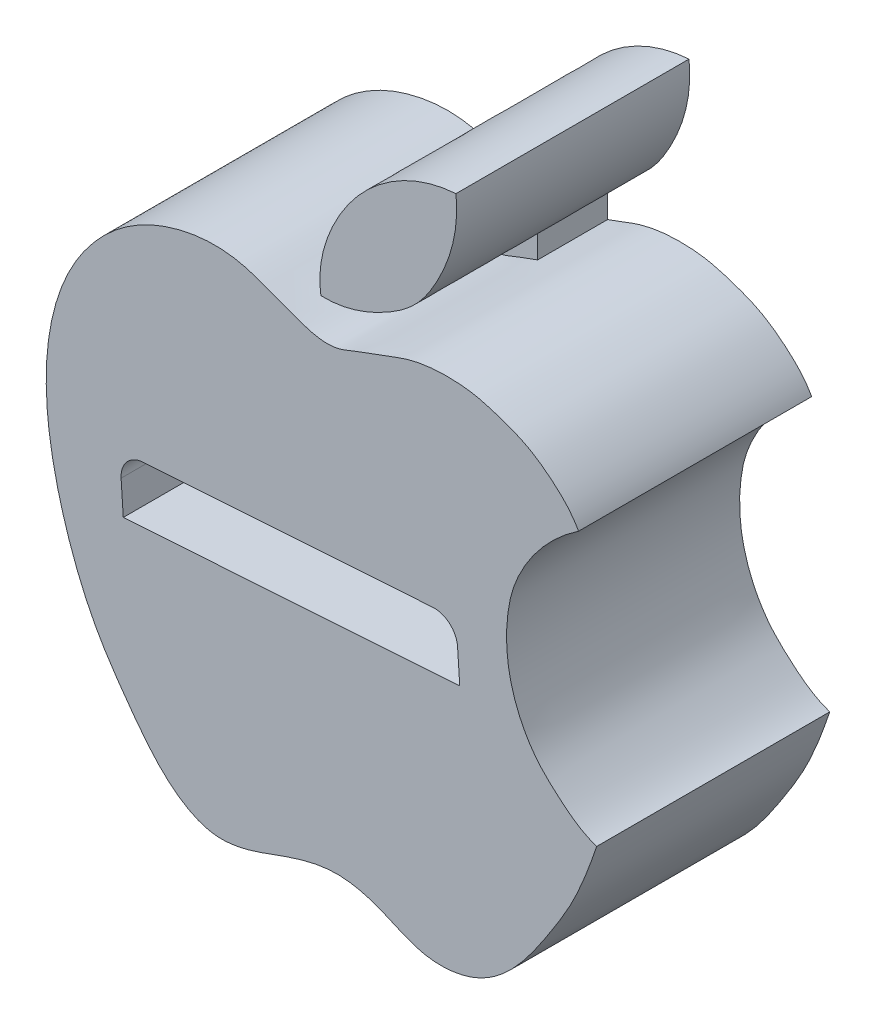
SolidWorks part; units mm, degrees
ref_plane "Front Plane" through (0, 0, 0) normal (0, 0, 1) x (1, 0, 0)
ref_plane "Top Plane" through (0, 0, 0) normal (0, 1, 0) x (1, 0, 0)
ref_plane "Right Plane" through (0, 0, 0) normal (1, 0, 0) x (0, 0, -1)
sketch "Sketch1"
  spline S0 degree 3 poles (226.9539, -62.4102) (214.1606, -58.2968) (197.4207, -45.402) (174.3626, -23.915) (159.2894, 1.2707) (149.2845, 34.7362) (148.9766, 65.5246) (153.5027, 89.4653) (167.156, 124.6374) (189.3818, 149.338) (211.4468, 164.1038) knots 0 0 0 0 0.142488 0.223895 0.337764 0.45251 0.59581 0.663481 0.71307 1 1 1 1
  spline S1 degree 3 poles (211.4468, 164.1038) (205.7181, 174.5433) (191.0904, 189.3967) (167.5659, 206.2266) (144.4457, 214.7907) (123.1417, 221.2843) (95.2038, 223.7881) (67.9232, 220.8773) (44.0446, 210.4677) (27.9655, 205.4946) (14.5837, 199.5799) (-1.3064, 194.155) (-19.6072, 197.1973) (-39.0105, 204.7876) (-56.0086, 211.0087) (-78.1896, 219.3022) (-99.5204, 221.5574) (-120.1174, 219.2611) (-136.4314, 215.7092) (-160.3796, 207.2608) (-186.4534, 190.6972) (-207.6833, 168.023) (-226.1212, 140.7454) (-237.2795, 112.2028) (-242.6466, 85.8497) (-245.8571, 59.7838) (-245.6066, 33.0315) (-240.9525, -6.1324) (-228.9343, -56.5948) (-206.7737, -112.2624) (-176.7871, -154.8899) (-155.0439, -184.1421) (-132.5344, -206.2953) (-103.7357, -219.9672) (-75.2959, -216.3483) (-40.6268, -203.4737) (-1.6938, -189.7969) (42.5018, -200.7795) (78.5928, -221.1352) (126.7878, -215.828) (161.4966, -184.6618) (185.0476, -149.6957) (209.7, -110.5439) (220.8635, -80.3256) (226.9539, -62.4102) knots 0 0 0 0 0.026752 0.046734 0.064997 0.082322 0.097011 0.128365 0.142996 0.155885 0.166411 0.176219 0.193415 0.206707 0.223677 0.234361 0.260338 0.271136 0.281277 0.298098 0.32847 0.350114 0.368075 0.40284 0.418567 0.428959 0.462303 0.478812 0.518264 0.579602 0.61296 0.636073 0.662146 0.684016 0.705484 0.7247 0.768618 0.794907 0.825219 0.861329 0.895482 0.927551 0.957031 1 1 1 1
  spline S2 degree 3 poles (-9.7343, 228.5639) (-12.7751, 248.9908) (-2.7414, 287.0768) (36.495, 340.3415) (79.0789, 360.521) (106.1612, 362.2894) knots 0 0 0 0 0.31387 0.584945 1 1 1 1
  spline S3 degree 3 poles (-9.7343, 228.5639) (8.7441, 227.8533) (38.8667, 237.8686) (71.7855, 260.2354) (98.5691, 300.134) (109.1361, 334.7644) (106.1612, 362.2894) knots 0 0 0 0 0.278566 0.466933 0.591977 1 1 1 1
extrude "Extrude1" add sketch "Sketch1" along normal blind 200
sketch "Esquisse1" plane through (0, 0, 0) normal (0, 0, -1) x (-1, 0, 0)
  line L1 (-36.3017, 252.7434) -> (4.4465, 252.7434)
  line L2 (-36.3017, 252.7434) -> (-36.3017, 176.1792)
  line L3 (-36.3017, 176.1792) -> (4.4465, 176.1792)
  line L4 (4.4465, 252.7434) -> (4.4465, 176.1792)
extrude "Boss.-Extru.1" add sketch "Esquisse1" against normal blind 60
sketch "Esquisse2" plane through (0, 0, 200) normal (0, 0, 1) x (1, 0, 0)
  line L0 (-182.4906, 27.1358) -> (106.241, 46.2963)
  line L1 (-182.4906, 27.1358) -> (-179.2921, -21.0642)
  line L2 (106.241, 46.2963) -> (109.4396, -1.9037)
  line L3 (-179.2921, -21.0642) -> (109.4396, -1.9037)
  dimension "D1" = 48.2
extrude "Enlèv. mat.-Extru.1" cut sketch "Esquisse2" against normal blind 154
fillet "Congé1" radius 20 2 edges at (106.241, 46.2963, 123) (-182.4906, 27.1358, 123)
scale "Echelle2" scale about origin uniform scaling yes scale factor 0.134
